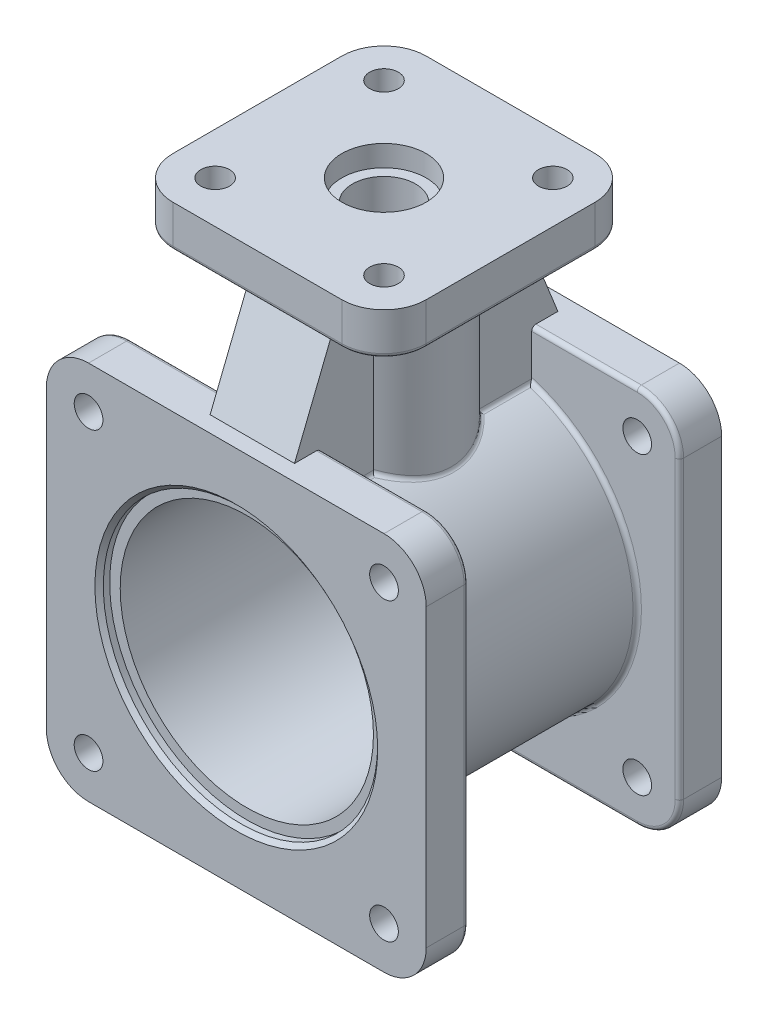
SolidWorks part; units mm, degrees
ref_plane "Front" through (0, 0, 0) normal (0, 0, 1) x (1, 0, 0)
ref_plane "Top" through (0, 0, 0) normal (0, 1, 0) x (1, 0, 0)
ref_plane "Right" through (0, 0, 0) normal (1, 0, 0) x (0, 0, -1)
sketch "Sketch1" plane through (0, 0, 0) normal (0, 0, 1) x (1, 0, 0)
  circle A0 centre (0, 0) radius 35
  dimension "D1" = 70
extrude "Boss-Extrude1" add sketch "Sketch1" along normal mid plane 70
sketch "Sketch2" plane through (0, 0, 35) normal (0, 0, 1) x (1, 0, 0)
  line L1 (-45, 45) -> (45, 45)
  line L2 (-45, 45) -> (-45, -45)
  line L3 (-45, -45) -> (45, -45)
  line L4 (45, 45) -> (45, -45)
  line L5 (-45, 45) -> (45, -45) construction
  line L6 (-45, -45) -> (45, 45) construction
  point P0 (0, 0)
  dimension "D1" = 90
  dimension "D2" = 90
extrude "Boss-Extrude2" add sketch "Sketch2" against normal blind 10
mirror "Mirror1" about plane through (0, 0, 0) normal (0, 0, 1) of "Boss-Extrude2"
ref_plane "Plane1" through (0, 73, 0) normal (0, 1, 0) x (1, 0, 0)
sketch "Sketch3" plane through (0, 73, 0) normal (0, 1, 0) x (1, 0, 0)
  circle A0 centre (0, 0) radius 16
  dimension "D1" = 32
extrude "Boss-Extrude3" add sketch "Sketch3" against normal up to next
sketch "Sketch4" plane through (0, 73, 0) normal (0, 1, 0) x (1, 0, 0)
  line L1 (-30, 30) -> (30, 30)
  line L2 (-30, 30) -> (-30, -30)
  line L3 (-30, -30) -> (30, -30)
  line L4 (30, 30) -> (30, -30)
  line L5 (-30, 30) -> (30, -30) construction
  line L6 (-30, -30) -> (30, 30) construction
  point P0 (0, 0)
  dimension "D1" = 60
  dimension "D2" = 60
extrude "Boss-Extrude4" add sketch "Sketch4" along normal blind 10
fillet "Fillet1" radius 10 12 edges at (30, 78, -30) (30, 78, 30) (-30, 78, 30) (-30, 78, -30) (-45, -45, -30) (45, -45, -30) (45, 45, -30) (-45, -45, 30) (45, -45, 30) (45, 45, 30) (-45, 45, 30) (-45, 45, -30)
sketch "Sketch5" plane through (0, 0, 0) normal (0, 1, 0) x (1, 0, 0)
  line L0 (-30, 32.5) -> (-32.5, 32.5)
  line L1 (-32.5, 32.5) -> (-32.5, 35)
  line L2 (-32.5, 35) -> (0, 35)
  line L3 (0, 35) -> (0, -35)
  line L4 (0, -35) -> (-32.5, -35)
  line L5 (-32.5, -35) -> (-32.5, -32.5)
  line L6 (-32.5, -32.5) -> (-30, -32.5)
  line L7 (-30, 32.5) -> (-30, -32.5)
  line L8 (35, -35) -> (-35, -35) construction
  line L9 (35, 35) -> (-35, 35) construction
  line L10 (23.3042, 0) -> (-50.6768, 0) construction
  line L11 (0, -45.0881) -> (0, 47.2856) construction
  dimension "D1" = 65
  dimension "D2" = 65
  dimension "D3" = 60
revolve "Cut-Revolve1" cut sketch "Sketch5" angle 360 about L11
sketch "Sketch6" plane through (0, 0, 0) normal (1, 0, 0) x (0, 0, -1)
  line L0 (-31.2, 45) -> (-20, 73)
  line L2 (-30, 73) -> (-20, 73) construction
  line L4 (-35, 45) -> (-35, 35) construction
  line L5 (-35, 45) -> (-25, 45) construction
  dimension "D1" = 10
  dimension "D2" = 3.8
rib "Rib1" sketch "Sketch6" sketch "Sketch6" thickness 20 extrusion direction parallel to sketch draft on no parameters "D1"=20
mirror "Mirror2" about plane through (0, 0, 0) normal (0, 0, 1) of "Rib1"
hole_wizard "M8x1.25 Tapped Hole1" positions "Sketch7" profile "Sketch8" tap size "M8x1.25" standard "ANSI Metric"
sketch "Sketch7" plane through (0, 0, 35) normal (0, 0, 1) x (1, 0, 0)
  arc A0 (-35, 45) -> (-45, 35) centre (-35, 35) ccw construction
  arc A1 (45, 35) -> (35, 45) centre (35, 35) ccw construction
  arc A2 (35, -45) -> (45, -35) centre (35, -35) ccw construction
  arc A3 (-45, -35) -> (-35, -45) centre (-35, -35) ccw construction
  point P0 (-35, 35)
  point P2 (35, 35)
  point P4 (35, -35)
  point P6 (-35, -35)
sketch "Sketch8" plane through (-35, 35, 35) normal (1, 0, 0) x (0, -1, 0)
  line L0 (0, 0) -> (0, 70)
  line L1 (0, 70) -> (3.4, 70)
  line L2 (3.4, 70) -> (3.4, 0)
  line L5 (3.4, 0) -> (0, 0)
  line L11 (0, -6.35) -> (0, 107.95) construction
  dimension "Thru Tap Drill Dia." = 6.8
  dimension "Thru Tap Drill Depth" = 70
hole_wizard "M8x1.25 Tapped Hole2" positions "Sketch10" profile "Sketch11" tap size "M8x1.25" standard "ANSI Metric"
sketch "Sketch10" plane through (0, 83, 0) normal (0, 1, 0) x (1, 0, 0)
  arc A0 (-30, -20) -> (-20, -30) centre (-20, -20) ccw construction
  arc A1 (20, -30) -> (30, -20) centre (20, -20) ccw construction
  arc A2 (30, 20) -> (20, 30) centre (20, 20) ccw construction
  arc A3 (-20, 30) -> (-30, 20) centre (-20, 20) ccw construction
  point P0 (-20, 20)
  point P2 (20, 20)
  point P4 (20, -20)
  point P6 (-20, -20)
sketch "Sketch11" plane through (-20, 83, -20) normal (1, 0, 0) x (0, 0, 1)
  line L0 (0, 0) -> (0, 10)
  line L1 (0, 10) -> (3.4, 10)
  line L2 (3.4, 10) -> (3.4, 0)
  line L5 (3.4, 0) -> (0, 0)
  line L11 (0, -6.35) -> (0, 107.95) construction
  dimension "Thru Tap Drill Dia." = 6.8
  dimension "Thru Tap Drill Depth" = 10
fillet "Fillet2" radius 1 18 edges at (-22.5, 45, -25) (-42.0711, 42.0711, -25) (-45, 0, -25) (-42.0711, -42.0711, -25) (0, -45, -25) (42.0711, -42.0711, -25) (22.5, 45, -25) (42.0711, 42.0711, -25) (-22.5, 45, 25) (-42.0711, 42.0711, 25) (-45, 0, 25) (-42.0711, -42.0711, 25) (0, -45, 25) (42.0711, -42.0711, 25) (22.5, 45, 25) (42.0711, 42.0711, 25) (45, 0, -25) (45, 0, 25)
fillet "Fillet3" radius 1 18 edges at (-16, 73, 0) (16, 73, 0) (-10, 33.541, -18.745) (-15.8288, 31.2162, -2.3345) (-10, 33.541, 18.745) (10, 33.541, -18.745) (15.9585, 31.15, -1.1512) (10, 33.541, 18.745) (0, -35, 25) (0, -35, -25) (-27.0711, 73, 27.0711) (-30, 73, 0) (-27.0711, 73, -27.0711) (0, 73, -30) (27.0711, 73, -27.0711) (30, 73, 0) (27.0711, 73, 27.0711) (0, 73, 30)
chamfer "Chamfer1" distance 1 angle 45 2 edges at (32.5, 0, -35) (32.5, 0, 35)
hole_wizard "Hole1" positions "Sketch13" profile "Sketch14" legacy
sketch "Sketch13" plane through (0, 83, 0) normal (0, 1, 0) x (1, 0, 0)
  point P0 (0, 0)
sketch "Sketch14" plane through (0, 83, 0) normal (1, 0, 0) x (0, 0, 1)
  line L0 (0, 0) -> (0, 57.5065)
  line L1 (0, 57.5065) -> (7.5, 53)
  line L2 (7.5, 53) -> (7.5, 5)
  line L3 (7.5, 5) -> (10, 5)
  line L4 (10, 0) -> (0, 0)
  line L5 (0, -11.3109) -> (0, 121.1557) construction
  line L6 (0, 57.5065) -> (-7.5, 53) construction
  line L7 (10, 5) -> (10, 0)
  dimension "Depth" = 53
  dimension "Drill Angle" = 118
  dimension "Diameter" = 15
  dimension "C-Bore Diameter" = 20
  dimension "C-Bore Depth" = 5
